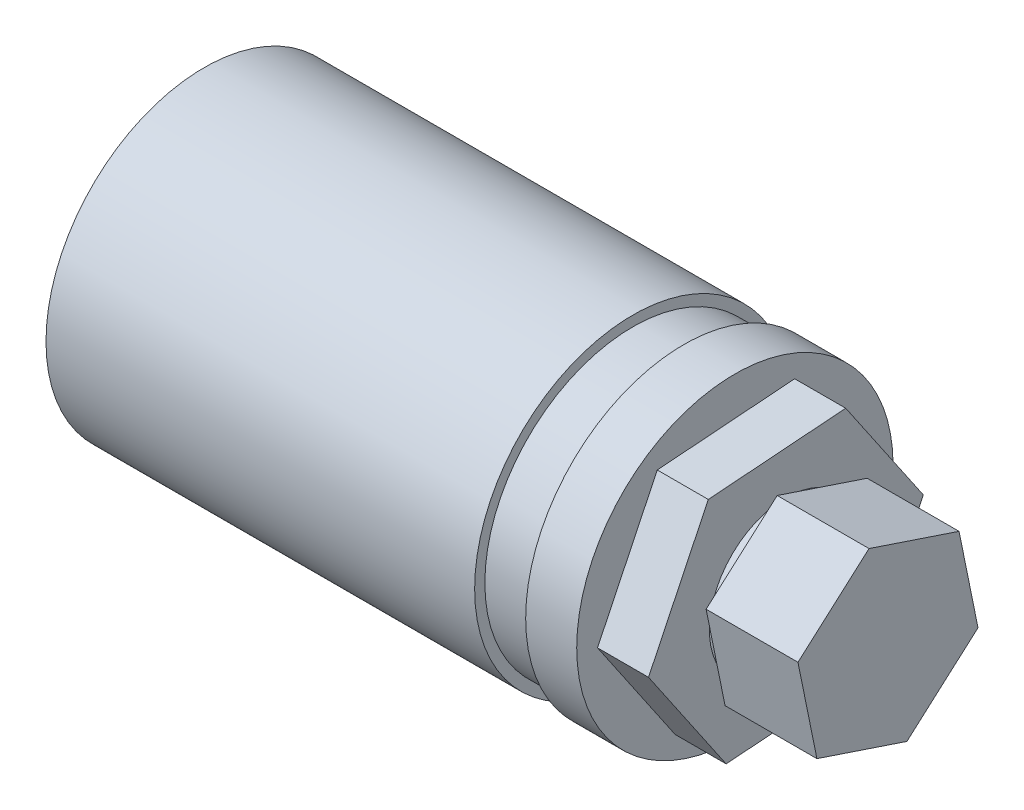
SolidWorks part; units mm, degrees
ref_plane "Alzado" through (0, 0, 0) normal (0, 0, 1) x (1, 0, 0)
ref_plane "Planta" through (0, 0, 0) normal (0, 1, 0) x (1, 0, 0)
ref_plane "Vista lateral" through (0, 0, 0) normal (1, 0, 0) x (0, 0, -1)
sketch "Croquis1" plane through (0, 0, 0) normal (0, 0, 1) x (1, 0, 0)
  line L0 (0, 0) -> (33.7038, 0) construction
  line L1 (0, 0) -> (0, 15.5)
  line L2 (0, 15.5) -> (42, 15.5)
  line L3 (42, 15.5) -> (42, 14.5)
  line L4 (42, 14.5) -> (47, 14.5)
  line L5 (47, 14.5) -> (47, 15.5)
  line L6 (47, 15.5) -> (52, 15.5)
  line L7 (52, 15.5) -> (52, 0)
  line L8 (52, 0) -> (0, 0)
  dimension "D1" = 31
  dimension "D2" = 1
  dimension "D3" = 42
  dimension "D4" = 5
revolve "Revolución1" add sketch "Croquis1" angle 360 about L0
sketch "Croquis2" plane through (52, 0, 0) normal (1, 0, 0) x (0, 0, -1)
  line L7 (-7.6055, 11.1538) -> (-13.4622, -1.0097)
  line L8 (-13.4622, -1.0097) -> (-5.8567, -12.1634)
  line L9 (-5.8567, -12.1634) -> (7.6055, -11.1538)
  line L10 (7.6055, -11.1538) -> (13.4622, 1.0097)
  line L11 (13.4622, 1.0097) -> (5.8567, 12.1634)
  line L12 (5.8567, 12.1634) -> (-7.6055, 11.1538)
  circle A0 centre (0, 0) radius 11.6913 construction
  dimension "D1" = 27
extrude "Saliente-Extruir1" add sketch "Croquis2" along normal blind 5
sketch "Croquis3" plane through (57, 0, 0) normal (1, 0, 0) x (0, 0, -1)
  circle A0 centre (0, 0) radius 7.5
  dimension "D1" = 15
extrude "Saliente-Extruir2" add sketch "Croquis3" along normal blind 1
sketch "Croquis4" plane through (58, 0, 0) normal (1, 0, 0) x (0, 0, -1)
  line L1 (-1.8577, 9.1126) -> (-8.8206, 2.9475)
  line L2 (-8.8206, 2.9475) -> (-6.9629, -6.1651)
  line L3 (-6.9629, -6.1651) -> (1.8577, -9.1126)
  line L4 (1.8577, -9.1126) -> (8.8206, -2.9475)
  line L5 (8.8206, -2.9475) -> (6.9629, 6.1651)
  line L6 (6.9629, 6.1651) -> (-1.8577, 9.1126)
  circle A0 centre (0, 0) radius 8.054 construction
  dimension "D1" = 18.6
extrude "Saliente-Extruir3" add sketch "Croquis4" along normal blind 9
